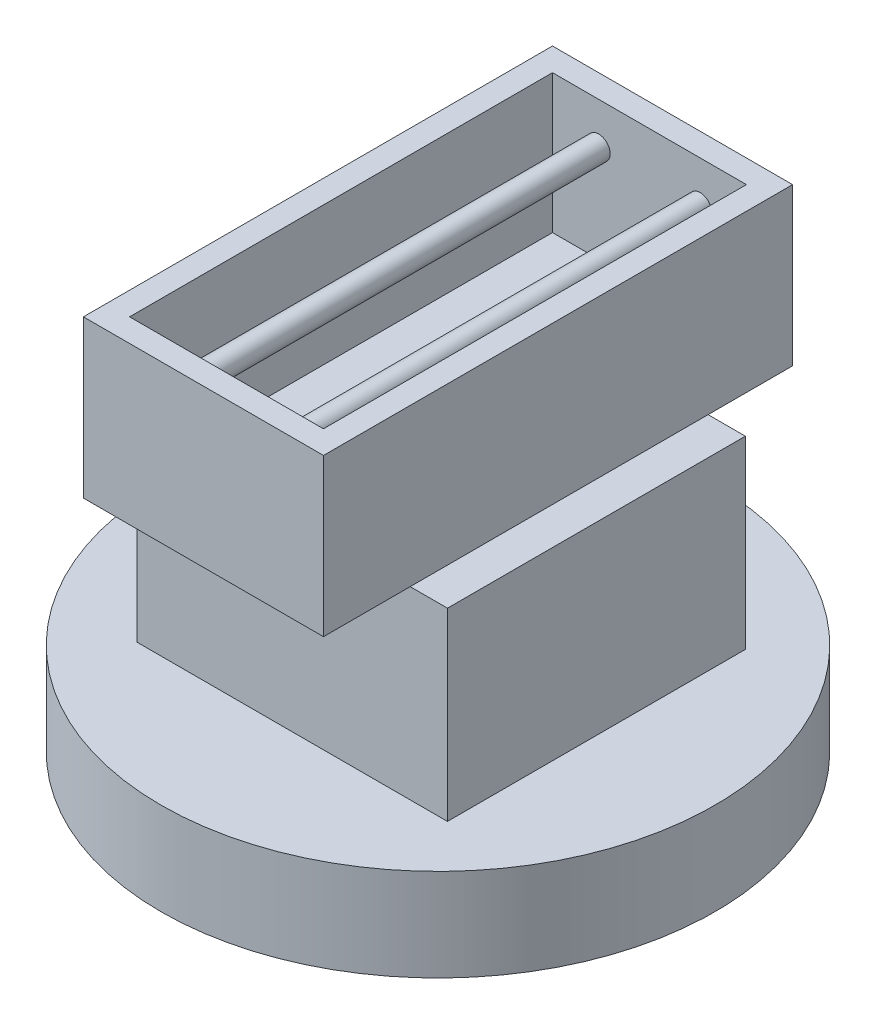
SolidWorks part; units mm, degrees
ref_plane "Front" through (0, 0, 0) normal (0, 0, 1) x (1, 0, 0)
ref_plane "Top" through (0, 0, 0) normal (0, 1, 0) x (1, 0, 0)
ref_plane "Right" through (0, 0, 0) normal (1, 0, 0) x (0, 0, -1)
sketch "Sketch1" plane through (0, 0, 0) normal (0, 1, 0) x (1, 0, 0)
  circle A0 centre (0, 0) radius 25
  dimension "D1" = 50
extrude "Extrude1" add sketch "Sketch1" against normal blind 20
sketch "Sketch9" plane through (0, 0, 0) normal (0, 1, 0) x (-1, 0, 0)
  circle A0 centre (0, 0) radius 60
extrude "Extrude5" add sketch "Sketch9" along normal blind 20
sketch "Sketch10" plane through (0, 20, 0) normal (0, 1, 0) x (-1, 0, 0)
  line L1 (-34.0744, -32.5029) -> (33.1711, -32.5029)
  line L2 (-34.0744, -32.5029) -> (-34.0744, 32.0256)
  line L3 (-34.0744, 32.0256) -> (33.1711, 32.0256)
  line L4 (33.1711, -32.5029) -> (33.1711, 32.0256)
extrude "Extrude6" add sketch "Sketch10" along normal blind 40
sketch "Sketch12" plane through (0, 60, 0) normal (0, 1, 0) x (-1, 0, 0)
  line L1 (-26, -50.8) -> (26, -50.8)
  line L2 (-26, -50.8) -> (-26, 50.8)
  line L3 (-26, 50.8) -> (26, 50.8)
  line L4 (26, -50.8) -> (26, 50.8)
  dimension "D1" = 101.6
  dimension "D2" = 52
  dimension "D3" = 26
  dimension "D4" = 50.8
extrude "Extrude7" add sketch "Sketch12" along normal blind 34
sketch "Sketch13" plane through (0, 94, 0) normal (0, 1, 0) x (-1, 0, 0)
  line L8 (-21, 45.8) -> (-21, -45.8)
  line L9 (-21, -45.8) -> (21, -45.8)
  line L10 (21, -45.8) -> (21, 45.8)
  line L11 (21, 45.8) -> (-21, 45.8)
  line L12 (-21, 45.8) -> (-21, -45.8)
  line L13 (-21, -45.8) -> (21, -45.8)
  line L14 (21, -45.8) -> (21, 45.8)
  line L15 (21, 45.8) -> (-21, 45.8)
  dimension "D1" = 5
extrude "Cut-Extrude1" cut sketch "Sketch13" against normal blind 30
sketch "Sketch14" plane through (0, 0, 50.8) normal (0, 0, 1) x (1, 0, 0)
  line L0 (-11, 101.625) -> (-11, 52.4705) construction
  line L1 (11, 101.625) -> (11, 52.4705) construction
  line L2 (-36.9756, 85) -> (36.3173, 85) construction
  line L3 (26, 94) -> (26, 60) construction
  line L4 (-26, 94) -> (-26, 60) construction
  line L5 (-26, 60) -> (26, 60) construction
  circle A0 centre (11, 85) radius 2.5
  circle A1 centre (-11, 85) radius 2.5
  dimension "D4" = 5
  dimension "D5" = 5
  dimension "D1" = 15
  dimension "D2" = 15
  dimension "D3" = 25
extrude "Extrude8" add sketch "Sketch14" against normal up to surface (101.6 mm away)
